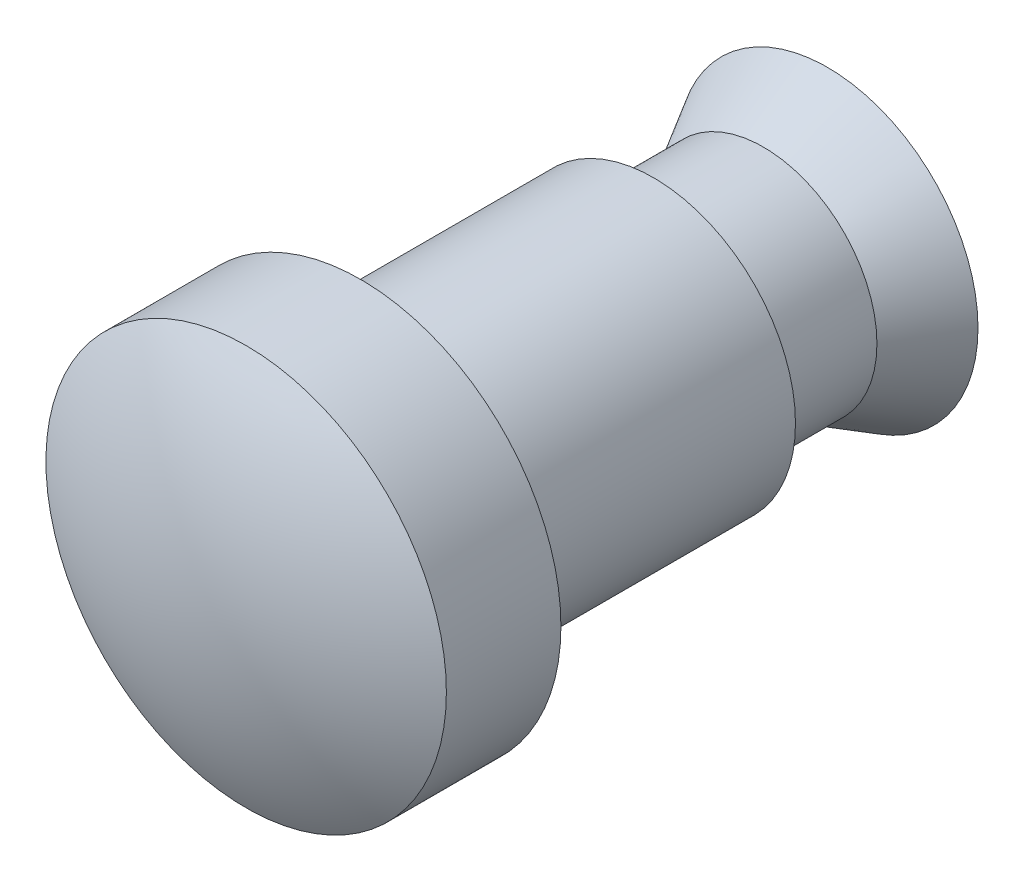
SolidWorks part; units mm, degrees
ref_plane "Спереди" through (0, 0, 0) normal (0, 0, 1) x (1, 0, 0)
ref_plane "Сверху" through (0, 0, 0) normal (0, 1, 0) x (1, 0, 0)
ref_plane "Справа" through (0, 0, 0) normal (1, 0, 0) x (0, 0, -1)
sketch "Эскиз1" plane through (0, 0, 0) normal (1, 0, 0) x (0, 0, -1)
  line L0 (0, 0) -> (8.8106, 0)
  line L1 (8.8106, 0) -> (8.8106, 2.0881)
  line L2 (8.8106, 2.0881) -> (7.9216, 1.5748)
  line L3 (7.9216, 1.5748) -> (6.3976, 1.5748)
  line L4 (6.3976, 1.5748) -> (6.3976, 1.9685)
  line L5 (6.3976, 1.9685) -> (2.3336, 1.9685)
  line L6 (2.3336, 1.9685) -> (2.3336, 2.7781)
  line L7 (2.3336, 2.7781) -> (0.7444, 2.7781)
  line L8 (0, 0) -> (53.5045, 0) construction
  arc A0 (0, 0) -> (0.7444, 2.7781) centre (5.5562, 0) cw
  dimension "D7" = 5.5562
  dimension "D1" = 2.413
  dimension "D2" = 30
  dimension "D3" = 0.889
  dimension "D4" = 3.1496
  dimension "D5" = 3.937
  dimension "D6" = 5.5562
  dimension "D8" = 4.064
  dimension "D9" = 2.3336
revolve "Повернуть1" add sketch "Эскиз1" angle 360 about L8
